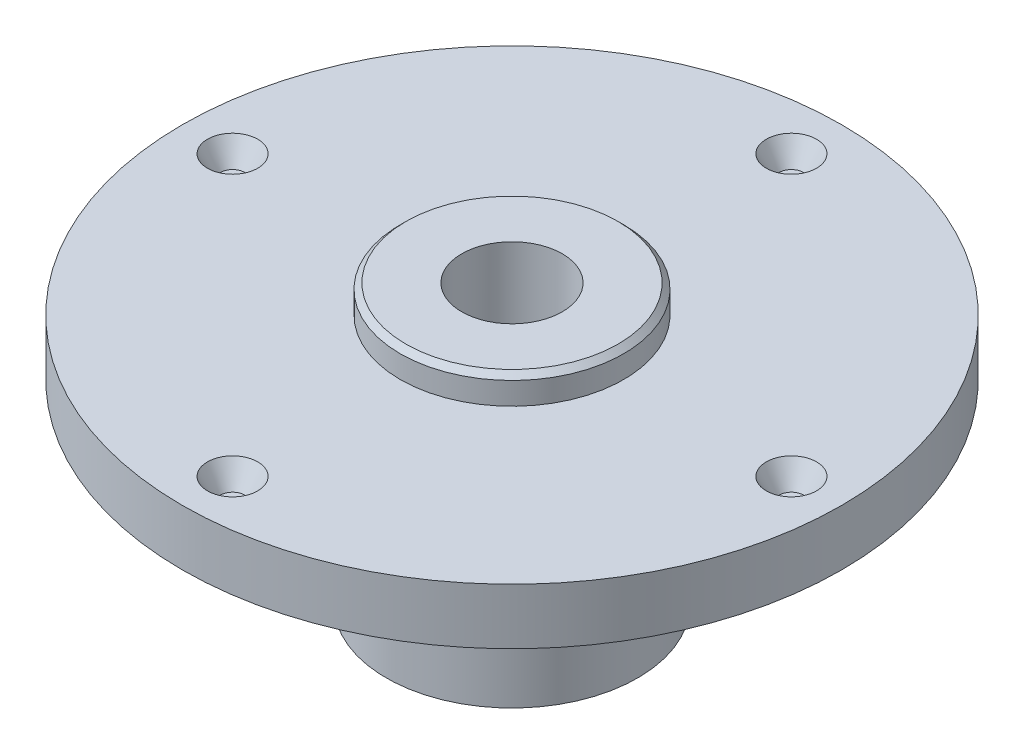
SolidWorks part; units mm, degrees
ref_plane "Plan1" through (0, 0, 0) normal (0, 0, 1) x (1, 0, 0)
ref_plane "Plan2" through (0, 0, 0) normal (0, 1, 0) x (1, 0, 0)
ref_plane "Plan3" through (0, 0, 0) normal (1, 0, 0) x (0, 0, -1)
sketch "Esquisse1" plane through (0, 0, 0) normal (0, 0, 1) x (1, 0, 0)
  line L0 (0, 0) -> (0, 114.474) construction
  line L1 (9, 0) -> (22.5, 0)
  line L2 (22.5, 0) -> (22.5, 35)
  line L3 (22.5, 35) -> (59, 35)
  line L4 (59, 35) -> (59, 45)
  line L5 (59, 45) -> (20, 45)
  line L6 (20, 45) -> (20, 50)
  line L7 (20, 50) -> (9, 50)
  line L8 (9, 50) -> (9, 0)
  dimension "D1" = 59
  dimension "D2" = 20
  dimension "D3" = 22.5
  dimension "D4" = 9
  dimension "D5" = 35
  dimension "D6" = 10
  dimension "D7" = 50
revolve "Base-Révolution" add sketch "Esquisse1" angle 360 about L0
sketch "Esquisse2" plane through (0, 0, 0) normal (0, 0, 1) x (1, 0, 0)
  line L0 (59, 45) -> (-59, 45) construction
  line L1 (50, 45) -> (45.5, 45)
  line L2 (45.5, 45) -> (47.8094, 41)
  line L3 (47.8094, 41) -> (50, 41)
  line L4 (50, 45) -> (50, 41)
  line L5 (50, 50.7977) -> (50, 31.3678) construction
  line L6 (0, -4.8796) -> (0, 59.6146) construction
  line L7 (0, 0) -> (0, 114.474) construction
  dimension "D1" = 50
  dimension "D2" = 30
  dimension "D3" = 4.5
  dimension "D4" = 4
revolve "Enlever de la matière-Révolution1" cut sketch "Esquisse2" angle 360 about L5
pattern_circular "Répétition circulaire1" count 4 over 360 about axis through (0, 0, 0) along (0, 1, 0)
sketch "Esquisse3" plane through (0, 0, 0) normal (1, 0, 0) x (0, 0, -1)
  line L0 (-22.5, 0) -> (22.5, 0) construction
  line L1 (0, 0) -> (0, 114.474) construction
  circle A0 centre (0, 15) radius 2.5
  dimension "D1" = 15
  dimension "D2" = 5
extrude "Enlèv. mat.-Extru.1" cut sketch "Esquisse3" against normal mid plane 45
chamfer "Chanfrein1" distance 1 angle 45
